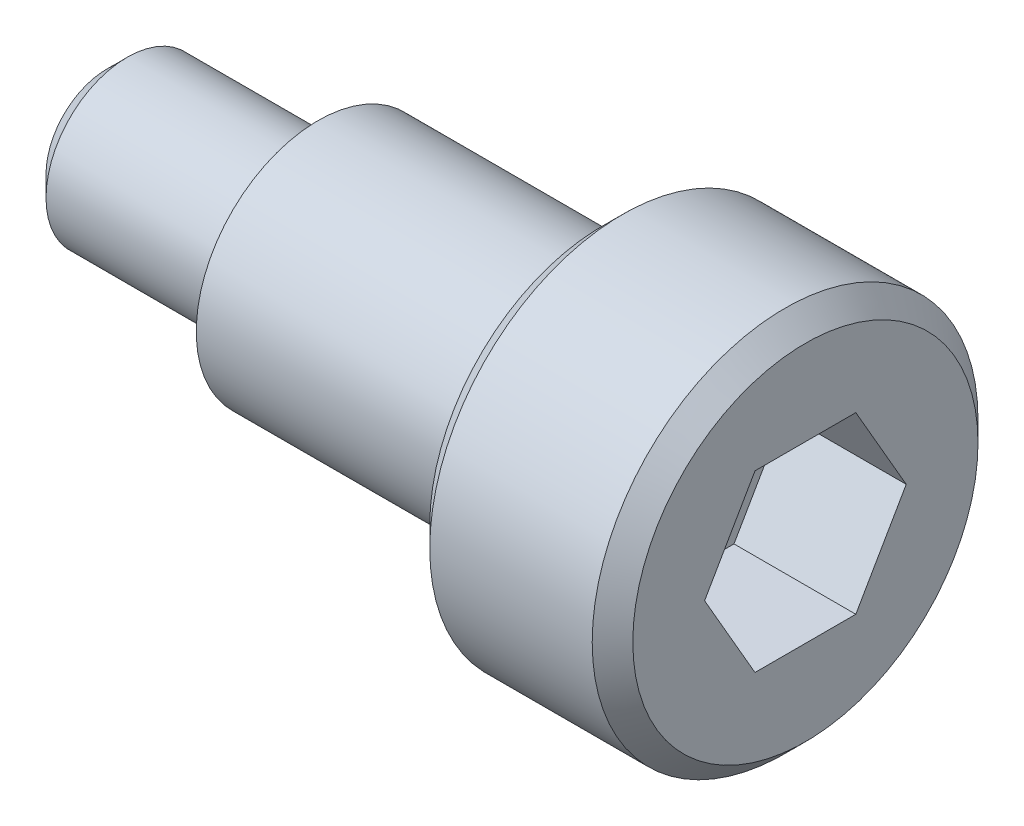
SolidWorks part; units mm, degrees
ref_plane "Front Plane" through (0, 0, 0) normal (0, 0, 1) x (1, 0, 0)
ref_plane "Top Plane" through (0, 0, 0) normal (0, 1, 0) x (1, 0, 0)
ref_plane "Right Plane" through (0, 0, 0) normal (1, 0, 0) x (0, 0, -1)
sketch "Sketch1" plane through (0, 0, 0) normal (0, 0, 1) x (1, 0, 0)
  line L0 (0, 0) -> (-17.2, 0) construction
  line L1 (0, 0) -> (0, 4.75)
  line L2 (0, 4.75) -> (-5, 4.75)
  line L3 (-5, 4.75) -> (-5, 3)
  line L4 (-5, 3) -> (-12, 3)
  line L5 (-12, 3) -> (-12, 2)
  line L6 (-12, 2) -> (-17.2, 2)
  line L7 (-17.2, 2) -> (-17.2, 0)
  line L8 (0, 0) -> (-17.2, 0)
  dimension "D1" = 17.2
  dimension "D2" = 4
  dimension "D3" = 6
  dimension "D4" = 9.5
  dimension "D5" = 5
  dimension "D6" = 12
revolve "Revolve1" add sketch "Sketch1" angle 360 about L0
chamfer "Chamfer1" distance 0.5 angle 45 3 edges at (-5, 0, -4.75) (0, 0, -4.75) (-17.2, 0, -2)
fillet "Fillet1" radius 0.5 1 edges at (-5, 0, -3)
sketch "Sketch2" plane through (0, 0, 0) normal (1, 0, 0) x (0, 0, -1)
  line L1 (2.4826, 0) -> (1.2413, 2.15)
  line L2 (1.2413, 2.15) -> (-1.2413, 2.15)
  line L3 (-1.2413, 2.15) -> (-2.4826, 0)
  line L4 (-2.4826, 0) -> (-1.2413, -2.15)
  line L5 (-1.2413, -2.15) -> (1.2413, -2.15)
  line L6 (1.2413, -2.15) -> (2.4826, 0)
  circle A0 centre (0, 0) radius 2.15 construction
  dimension "D1" = 4.3
extrude "Cut-Extrude1" cut sketch "Sketch2" against normal blind 3
